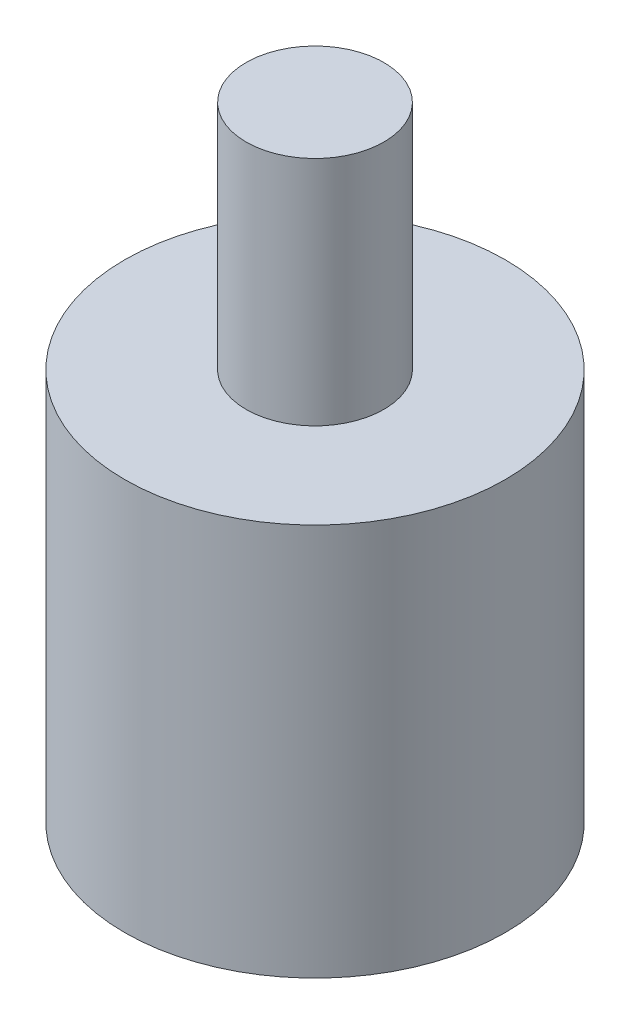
SolidWorks part; units mm, degrees
ref_plane "Front Plane" through (0, 0, 0) normal (0, 0, 1) x (1, 0, 0)
ref_plane "Top Plane" through (0, 0, 0) normal (0, 1, 0) x (1, 0, 0)
ref_plane "Right Plane" through (0, 0, 0) normal (1, 0, 0) x (0, 0, -1)
sketch "Sketch1" plane through (0, 0, 0) normal (0, 1, 0) x (1, 0, 0)
  circle A0 centre (0, 0) radius 9.945
  dimension "D1" = 19.89
extrude "Boss-Extrude1" add sketch "Sketch1" along normal blind 20.5
sketch "Sketch2" plane through (0, 20.5, 0) normal (0, 1, 0) x (1, 0, 0)
  circle A0 centre (0, 0) radius 3.6
  dimension "D1" = 7.2
extrude "Boss-Extrude2" add sketch "Sketch2" along normal blind 12.1
